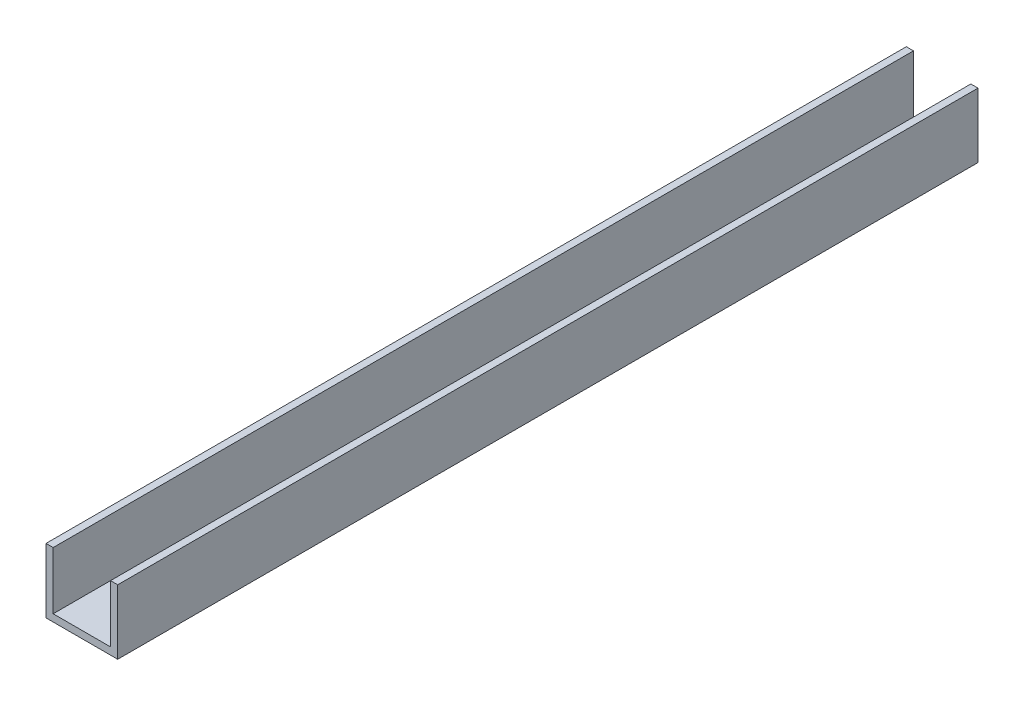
SolidWorks part; units mm, degrees
ref_plane "Front" through (0, 0, 0) normal (0, 0, 1) x (1, 0, 0)
ref_plane "Top" through (0, 0, 0) normal (0, 1, 0) x (1, 0, 0)
ref_plane "Right" through (0, 0, 0) normal (1, 0, 0) x (0, 0, -1)
sketch "Sketch1" plane through (0, 0, 0) normal (0, 0, 1) x (1, 0, 0)
  line L0 (0, -7.1438) -> (0, 7.1438) construction
  line L1 (-7.9375, 0) -> (7.9375, 0) construction
  line L2 (6.35, 7.1438) -> (-6.35, 7.1438) construction
  line L3 (-7.9375, -7.1437) -> (7.9375, -7.1437)
  line L4 (-7.9375, -7.1437) -> (-7.9375, 7.1438)
  line L5 (-7.9375, 7.1438) -> (7.9375, 7.1438)
  line L6 (7.9375, -7.1437) -> (7.9375, 7.1438)
  line L7 (-7.9375, -7.1437) -> (7.9375, 7.1438) construction
  line L8 (-7.9375, 7.1438) -> (7.9375, -7.1437) construction
  line L9 (-6.35, -7.1438) -> (6.35, -7.1437)
  point P3 (0, 0)
  point P4 (0, 0)
  point P8 (0, 0)
  point P13 (7.9375, -5.5562)
  point P17 (0, 7.1438)
  point P20 (0, -7.1438)
sketch "Sketch2" plane through (0, 0, 0) normal (1, 0, 0) x (0, 0, -1)
  line L0 (-95.25, 0) -> (95.25, 0) construction
sketch "Sketch3" plane through (0, 0, 0) normal (0, 0, 1) x (1, 0, 0)
  line L0 (-7.9375, 7.1438) -> (-7.9375, -7.1437)
  line L1 (-7.9375, -7.1437) -> (7.9375, -7.1437)
  line L2 (7.9375, -7.1437) -> (7.9375, 7.1438)
  line L3 (7.9375, 7.1438) -> (6.35, 7.1438)
  line L4 (6.35, 7.1438) -> (6.35, -5.5562)
  line L5 (6.35, -5.5562) -> (-6.35, -5.5562)
  line L6 (-6.35, -5.5562) -> (-6.35, 7.1438)
  line L7 (-6.35, 7.1438) -> (-7.9375, 7.1438)
  line L8 (-6.35, -5.5562) -> (-6.35, -7.1437) construction
extrude "Boss-Extrude2" add sketch "Sketch3" along normal mid plane 190.5
sketch "Reference Sketch1" plane through (0, 0, 0) normal (1, 0, 0) x (0, 0, -1)
  line L0 (-95.25, 0) -> (95.25, 0) construction
  point P0 (-70.2469, 0)
  point P1 (70.2469, 0)
sketch "Sketch4" plane through (0, -5.5562, 0) normal (0, 1, 0) x (1, 0, 0)
  line L0 (0, -95.25) -> (0, -90.4875) construction
  line L1 (6.35, -95.25) -> (-6.35, -95.25) construction
  line L2 (0, -90.4875) -> (0, -79.375) construction
  line L3 (0, 95.25) -> (0, 90.4875) construction
  line L4 (6.35, 95.25) -> (-6.35, 95.25) construction
  line L5 (0, 90.4875) -> (0, 79.375) construction
  circle A1 centre (0, -79.375) radius 1.5875
  circle A2 centre (0, 79.375) radius 1.5875
extrude "Cut-Extrude1" cut sketch "Sketch4" against normal through all
equation "\"D1@Sketch3\" = \"Outside Height@Sketch1\""
equation "\"D2@Sketch3\" = \"Outside Width@Sketch1\""
equation "\"D3@Sketch3\" = \"Wall Thickness@Sketch1\""
equation "\"D1@Reference Sketch1\"=\"Outside Height@Sketch1\" * 1.75"
equation "\"D2@Reference Sketch1\" = \"D1@Reference Sketch1\""
equation "\"D1@Boss-Extrude2\" = \"Length@Sketch2\""
equation "\"Inside Height@Sketch1\"=\"Outside Height@Sketch1\"-\"Wall Thickness@Sketch1\""
equation "\"Inside Width@Sketch1\"=\"Outside Width@Sketch1\"-\"Wall Thickness@Sketch1\"*2"
